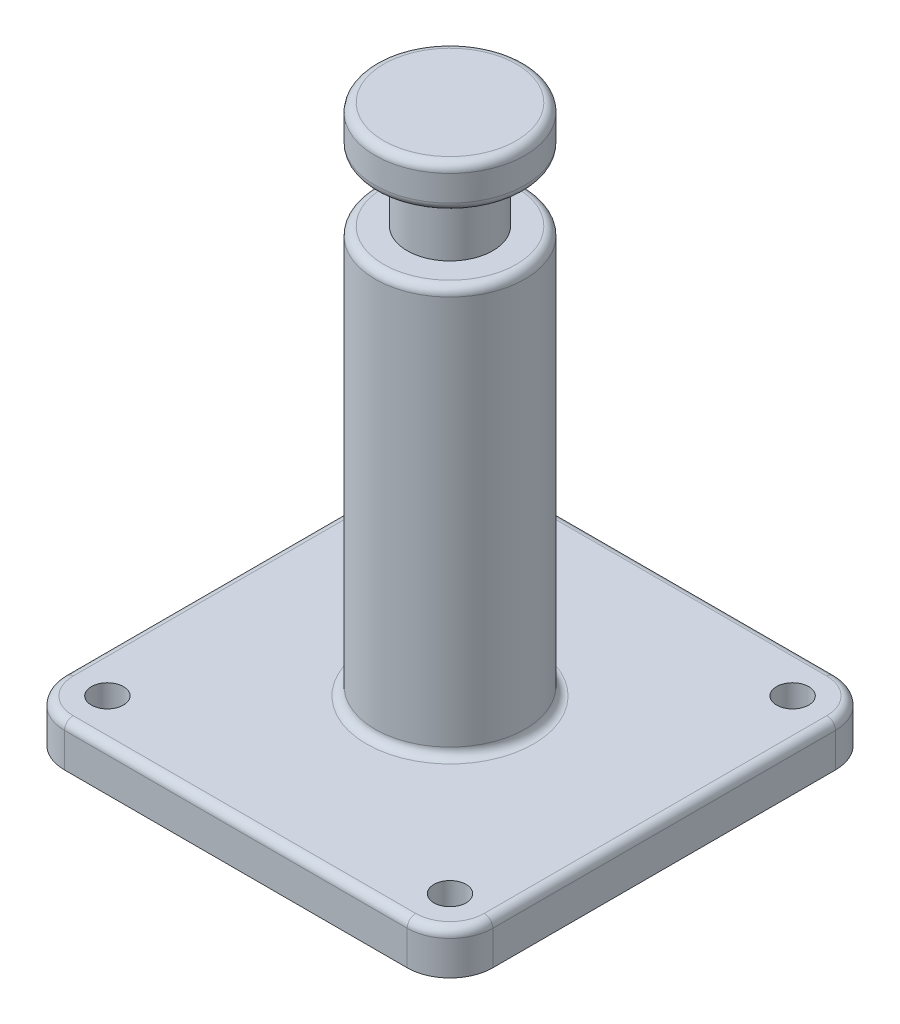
SolidWorks part; units mm, degrees
ref_plane "Front Plane" through (0, 0, 0) normal (0, 0, 1) x (1, 0, 0)
ref_plane "Top Plane" through (0, 0, 0) normal (0, 1, 0) x (1, 0, 0)
ref_plane "Right Plane" through (0, 0, 0) normal (1, 0, 0) x (0, 0, -1)
sketch "Sketch1" plane through (0, 0, 0) normal (0, 1, 0) x (1, 0, 0)
  line L0 (-63.5, -63.5) -> (63.5, 63.5) construction
  line L1 (-50.8, -63.5) -> (50.8, -63.5)
  line L2 (-63.5, -50.8) -> (-63.5, 50.8)
  line L3 (-50.8, 63.5) -> (50.8, 63.5)
  line L4 (63.5, -50.8) -> (63.5, 50.8)
  arc A0 (50.8, -63.5) -> (63.5, -50.8) centre (50.8, -50.8) ccw
  arc A1 (50.8, 63.5) -> (63.5, 50.8) centre (50.8, 50.8) cw
  arc A2 (-63.5, 50.8) -> (-50.8, 63.5) centre (-50.8, 50.8) cw
  arc A3 (-50.8, -63.5) -> (-63.5, -50.8) centre (-50.8, -50.8) cw
  circle A4 centre (-50.8, 50.8) radius 4.7625
  circle A5 centre (50.8, 50.8) radius 4.7625
  circle A6 centre (50.8, -50.8) radius 4.7625
  circle A7 centre (-50.8, -50.8) radius 4.7625
  point P11 (-63.5, 63.5)
  dimension "D3" = 12.7
  dimension "D4" = 9.525
  dimension "D1" = 127
  dimension "D2" = 127
extrude "Extrude1" add sketch "Sketch1" along normal blind 12.7
sketch "Sketch3" plane through (0, 0, 0) normal (0, 0, 1) x (1, 0, 0)
  line L0 (0, 0) -> (0, 245.8061) construction
  line L1 (0, 165.1) -> (22.225, 165.1)
  line L2 (22.225, 165.1) -> (22.225, 152.4)
  line L3 (22.225, 152.4) -> (12.7, 152.4)
  line L4 (12.7, 152.4) -> (12.7, 133.35)
  line L5 (12.7, 133.35) -> (22.225, 133.35)
  line L6 (22.225, 133.35) -> (22.225, 12.7)
  line L7 (22.225, 12.7) -> (0, 12.7)
  line L9 (-50.8, 12.7) -> (50.8, 12.7) construction
  line L10 (0, 165.1) -> (0, 12.7)
  dimension "D1" = 19.05
  dimension "D2" = 152.4
  dimension "D3" = 12.7
  dimension "D4" = 22.225
  dimension "D5" = 12.7
revolve "Revolve1" add sketch "Sketch3" angle 360 about L0
fillet "Fillet2" radius 2.54 12 edges at (-59.7803, 12.7, 59.7803) (-63.5, 12.7, 0) (-59.7803, 12.7, -59.7803) (0, 12.7, -63.5) (59.7803, 12.7, -59.7803) (63.5, 12.7, 0) (59.7803, 12.7, 59.7803) (0, 12.7, 63.5) (0, 12.7, 22.225) (0, 133.35, -22.225) (0, 152.4, -22.225) (0, 165.1, -22.225)
